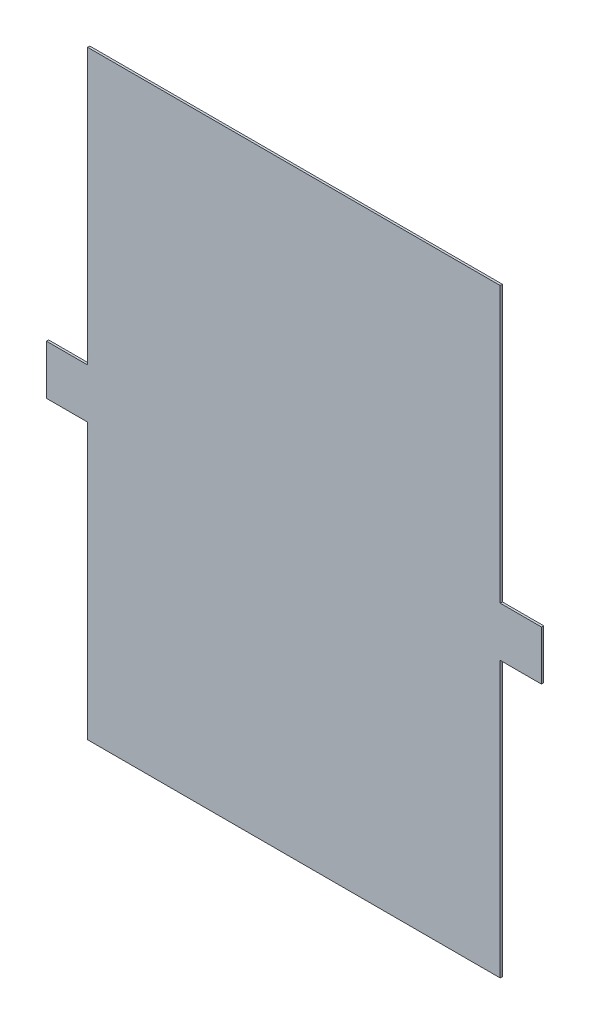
SolidWorks part; units mm, degrees
ref_plane "Front Plane" through (0, 0, 0) normal (0, 0, 1) x (1, 0, 0)
ref_plane "Top Plane" through (0, 0, 0) normal (0, 1, 0) x (1, 0, 0)
ref_plane "Right Plane" through (0, 0, 0) normal (1, 0, 0) x (0, 0, -1)
sketch "Sketch1" plane through (0, 0, 0) normal (0, 0, 1) x (1, 0, 0)
  line L0 (129.4319, 13.961) -> (167.5319, 13.961)
  line L1 (-251.5681, 267.961) -> (129.4319, 267.961)
  line L2 (-251.5681, 267.961) -> (-251.5681, 13.961)
  line L3 (-251.5681, -285.759) -> (129.4319, -285.759)
  line L4 (129.4319, 267.961) -> (129.4319, 13.961)
  line L5 (167.5319, 13.961) -> (167.5319, -31.759)
  line L6 (167.5319, -31.759) -> (129.4319, -31.759)
  line L7 (-251.5681, 13.961) -> (-289.6681, 13.961)
  line L8 (-289.6681, 13.961) -> (-289.6681, -31.759)
  line L9 (-289.6681, -31.759) -> (-251.5681, -31.759)
  line L10 (-251.5681, -31.759) -> (-251.5681, -285.759)
  line L11 (129.4319, -31.759) -> (129.4319, -285.759)
  dimension "D1" = 381
  dimension "D2" = 553.72
  dimension "D3" = 45.72
  dimension "D4" = 254
  dimension "D5" = 38.1
  dimension "D6" = 38.1
  dimension "D7" = 45.72
extrude "Boss-Extrude1" add sketch "Sketch1" along normal blind 2.032
